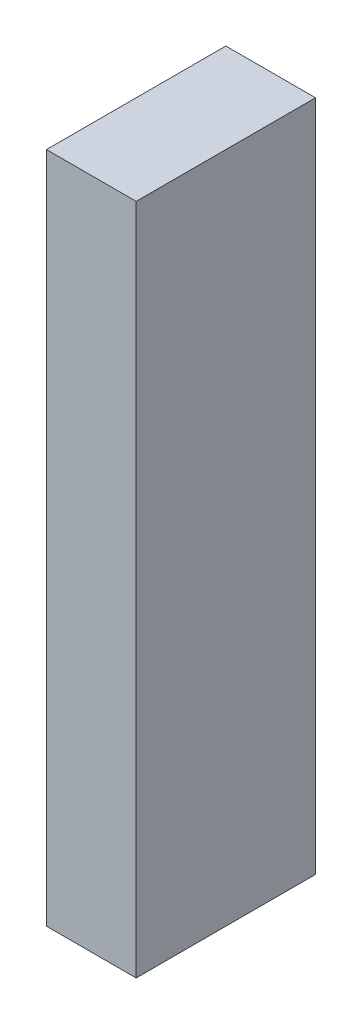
SolidWorks part; units mm, degrees
ref_plane "Front Plane" through (0, 0, 0) normal (0, 0, 1) x (1, 0, 0)
ref_plane "Top Plane" through (0, 0, 0) normal (0, 1, 0) x (1, 0, 0)
ref_plane "Right Plane" through (0, 0, 0) normal (1, 0, 0) x (0, 0, -1)
sketch "Sketch1" plane through (0, 0, 0) normal (0, 1, 0) x (1, 0, 0)
  line L1 (25, -50) -> (-25, -50)
  line L2 (25, -50) -> (25, 50)
  line L3 (25, 50) -> (-25, 50)
  line L4 (-25, -50) -> (-25, 50)
  line L5 (25, -50) -> (-25, 50) construction
  line L6 (25, 50) -> (-25, -50) construction
  point P0 (0, 0)
  dimension "D1" = 100
  dimension "D2" = 50
extrude "Boss-Extrude1" add sketch "Sketch1" along normal blind 375
